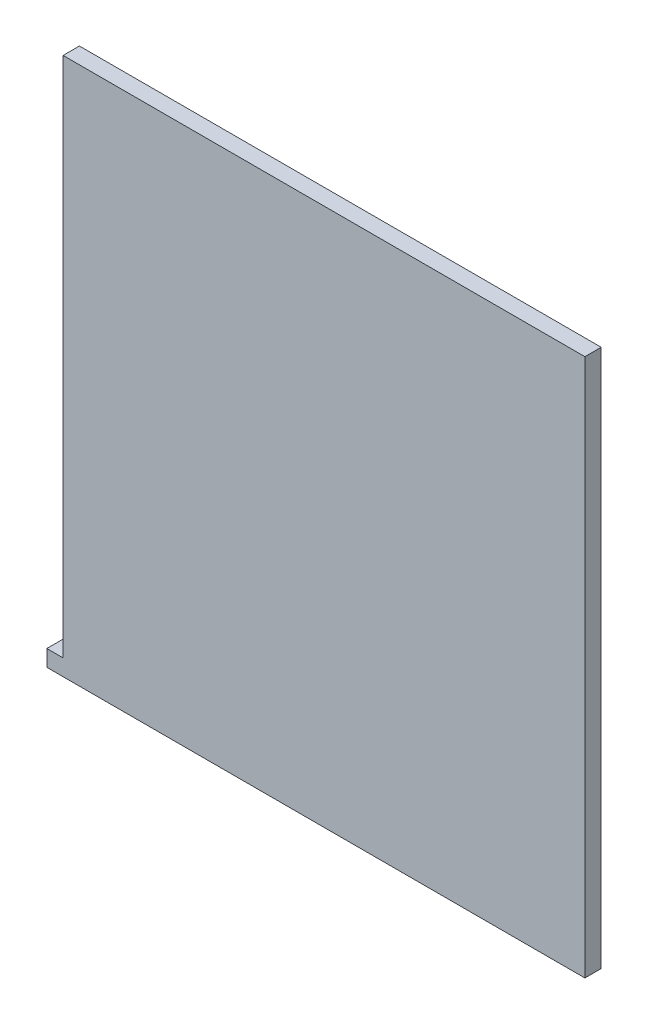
SolidWorks part; units mm, degrees
ref_plane "Front" through (0, 0, 0) normal (0, 0, 1) x (1, 0, 0)
ref_plane "Top" through (0, 0, 0) normal (0, 1, 0) x (1, 0, 0)
ref_plane "Right" through (0, 0, 0) normal (1, 0, 0) x (0, 0, -1)
sketch "Sketch1" plane through (0, 0, 0) normal (0, 0, 1) x (1, 0, 0)
  line L0 (-203.2, 209.55) -> (203.2, -209.55) construction
  line L1 (-215.9, -209.55) -> (-215.9, -196.85)
  line L2 (-203.2, 209.55) -> (-203.2, -196.85)
  line L3 (-215.9, -209.55) -> (203.2, -209.55)
  line L4 (203.2, 209.55) -> (203.2, -196.85)
  line L5 (-215.9, -196.85) -> (-203.2, -196.85)
  line L6 (203.2, -209.55) -> (203.2, -196.85)
  line L9 (-203.2, 209.55) -> (203.2, 209.55)
  point P0 (0, 0)
  dimension "D1" = 406.4
  dimension "D2" = 419.1
  dimension "D3" = 12.7
  dimension "D4" = 12.7
  dimension "D6" = 12.7
extrude "Extrude1" add sketch "Sketch1" along normal blind 12.7
